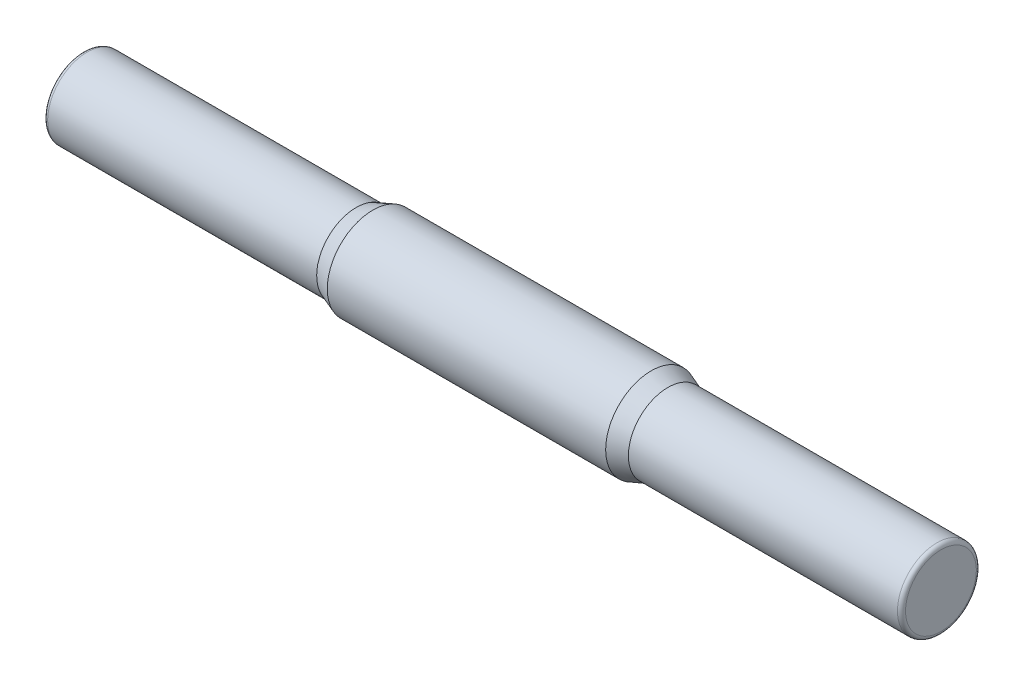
SolidWorks part; units mm, degrees
ref_plane "Front Plane" through (0, 0, 0) normal (0, 0, 1) x (1, 0, 0)
ref_plane "Top Plane" through (0, 0, 0) normal (0, 1, 0) x (1, 0, 0)
ref_plane "Right Plane" through (0, 0, 0) normal (1, 0, 0) x (0, 0, -1)
sketch "Sketch1" plane through (0, 0, 0) normal (1, 0, 0) x (0, 0, -1)
  circle A0 centre (91.9854, 867.2016) radius 22.5 construction
  circle A1 centre (91.9854, 867.2016) radius 22.5
extrude "Boss-Extrude1" add sketch "Sketch1" along normal mid plane 420
sketch "Sketch2" plane through (-210, 0, 0) normal (-1, 0, 0) x (0, 0, 1)
  circle A0 centre (-91.9854, 867.2016) radius 17.5
  dimension "D1" = 35
extrude "Cut-Extrude-Thin1" cut sketch "Sketch2" against normal blind 100 flip side to cut thin
mirror "Mirror1" about plane through (0, 0, 0) normal (1, 0, 0) of "Cut-Extrude-Thin1"
chamfer "Chamfer1" distance 15 angle 70 1 edges at (110, 867.2016, -69.4854)
chamfer "Chamfer2" distance 15 angle 70 1 edges at (-110, 867.2016, -69.4854)
ref_plane "Plane1" through (0, 817.3904, -144.128) normal (0, 0.9848, -0.1736) x (1, 0, 0)
ref_plane "Plane2" through (0, 856.7827, -151.0739) normal (0, 0.9848, -0.1736) x (1, 0, 0)
sketch "Sketch3" plane through (0, 856.7827, -151.0739) normal (0, 0.9848, -0.1736) x (1, 0, 0)
  line L0 (-82.5252, -77.5) -> (-68.7878, -82.5) construction
  line L1 (-210, -77.5) -> (-82.5252, -77.5) construction
  line L2 (-82.5252, -77.5) -> (-77.0303, -79.5)
  line L3 (-210, -77.5) -> (-82.5252, -77.5)
  line L4 (-210, -60) -> (-210, -77.5)
  line L5 (-210, -42.5) -> (-210, -77.5) construction
  line L6 (-210, -60) -> (-212, -60)
  line L7 (-212, -60) -> (-212, -77.5)
  line L8 (-210, -79.5) -> (-77.0303, -79.5)
  line L9 (-221.2899, -60) -> (-62.4423, -60) construction
  arc A0 (-212, -77.5) -> (-210, -79.5) centre (-210, -77.5) ccw
  dimension "D3" = 2
  dimension "D1" = 2
  dimension "D2" = 2
revolve "Revolve1" add sketch "Sketch3" angle 360 about L9
mirror "Mirror8" about plane through (0, 0, 0) normal (1, 0, 0) of "Revolve1"
